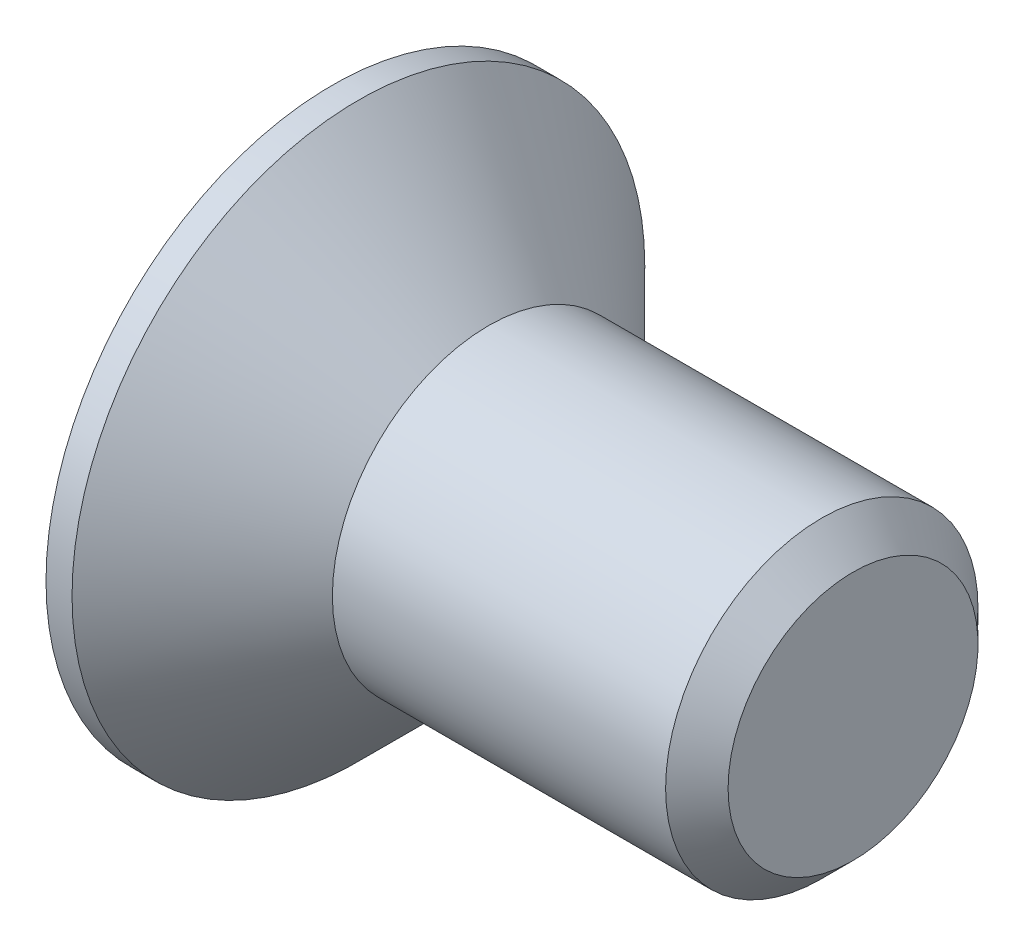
SolidWorks part; units mm, degrees
ref_plane "Front Plane" through (0, 0, 0) normal (0, 0, 1) x (1, 0, 0)
ref_plane "Top Plane" through (0, 0, 0) normal (0, 1, 0) x (1, 0, 0)
ref_plane "Right Plane" through (0, 0, 0) normal (1, 0, 0) x (0, 0, -1)
sketch "Sketch1" plane through (0, 0, 0) normal (0, 0, 1) x (1, 0, 0)
  line L1 (-3, 5.5) -> (-3, 0)
  line L2 (-3, 0) -> (7, 0)
  line L3 (7, 0) -> (7, 3)
  line L4 (7, 3) -> (0, 3)
  line L5 (-3, 5.5) -> (-2.5, 5.5)
  line L6 (-2.5, 5.5) -> (0, 3)
  dimension "D1" = 3
  dimension "D2" = 45
  dimension "D3" = 3
  dimension "D4" = 10
  dimension "D5" = 5.5
revolve "Revolve1" add sketch "Sketch1" angle 360 about L2
chamfer "Chamfer1" distance 0.6 angle 45 1 edges at (7, 0, 3)
sketch "Sketch2" plane through (-3, 0, 0) normal (-1, 0, 0) x (0, 0, 1)
  line L0 (-0.825, 3.3) -> (0.825, 3.3)
  line L1 (0.825, 3.3) -> (0.825, 0.825)
  line L2 (0.825, 0.825) -> (3.3, 0.825)
  line L3 (3.3, 0.825) -> (3.3, -0.825)
  line L4 (3.3, -0.825) -> (0.825, -0.825)
  line L5 (0.825, -0.825) -> (0.825, -3.3)
  line L6 (0.825, -3.3) -> (-0.825, -3.3)
  line L7 (-0.825, -3.3) -> (-0.825, -0.825)
  line L8 (-0.825, -0.825) -> (-3.3, -0.825)
  line L9 (-3.3, -0.825) -> (-3.3, 0.825)
  line L10 (-3.3, 0.825) -> (-0.825, 0.825)
  line L11 (-0.825, 0.825) -> (-0.825, 3.3)
  point P2 (0, 3.3)
  point P14 (0, -3.3)
  point P15 (3.3, 0)
  point P16 (-3.3, 0)
  dimension "D1" = 6.6
  dimension "D2" = 1.65
extrude "Cut-Extrude1" cut sketch "Sketch2" against normal blind 2.5
